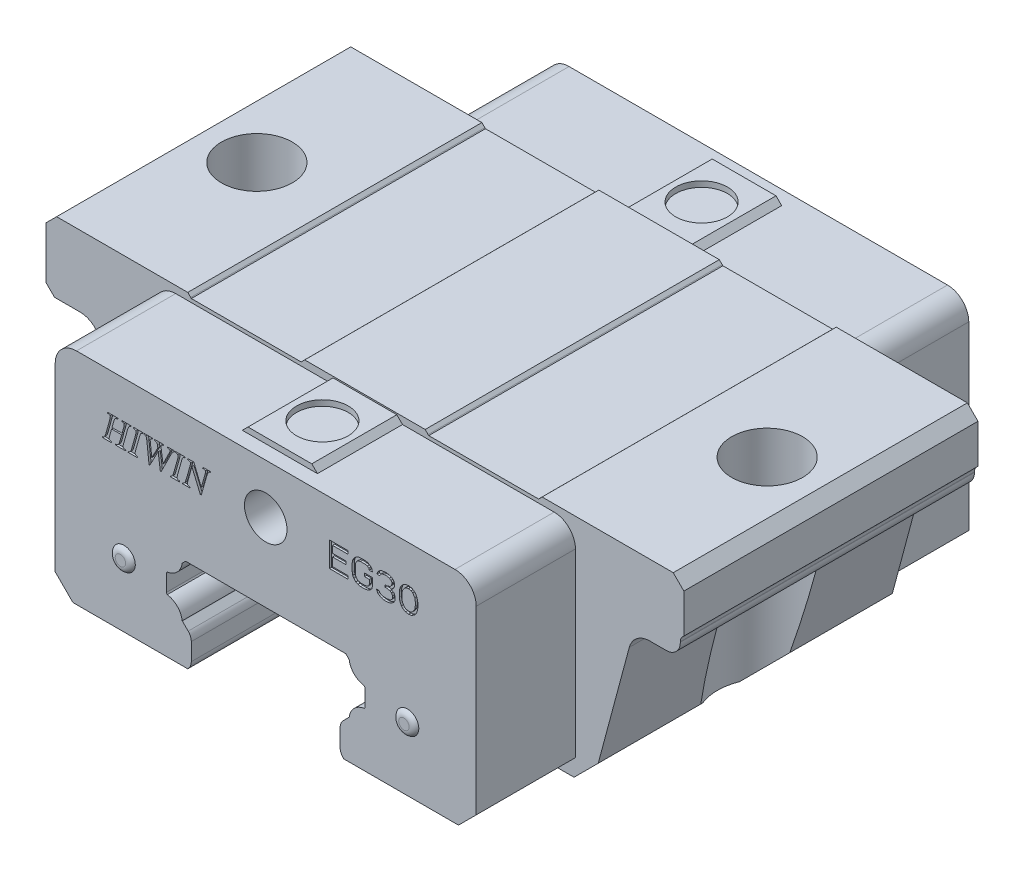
SolidWorks part; units mm, degrees
ref_plane "前视基准面" through (0, 0, 0) normal (0, 0, 1) x (1, 0, 0)
ref_plane "上视基准面" through (0, 0, 0) normal (0, 1, 0) x (1, 0, 0)
ref_plane "右视基准面" through (0, 0, 0) normal (1, 0, 0) x (0, 0, -1)
imported_body "输入1"
sketch "草图1" plane through (0, 0, 14) normal (0, 0, 1) x (1, 0, 0)
  line L0 (0, 0) -> (0, -23) construction
  line L1 (-43.5, 19) -> (-25, 19) construction
  line L23 (-10.9393, -12.9393) -> (-13.5607, -15.5607)
  line L24 (-11.7582, -7.5418) -> (-10.9393, -8.3607)
  line L25 (4.5, -22.5) -> (5, -23)
  line L26 (10.5, -11.8787) -> (10.5, -9.4213)
  line L27 (14, -5.152) -> (14, -2.848)
  line L28 (-5, -23) -> (5, -23) construction
  line L29 (-12.5, -23) -> (-5, -23)
  line L30 (-5, -23) -> (-4.5, -22.5)
  line L31 (-14, -21.5) -> (-12.5, -23)
  line L32 (10.9393, -8.3607) -> (11.7582, -7.5418)
  line L33 (-11.3, 0) -> (-11.7582, -0.4582)
  line L34 (14, -21.5) -> (14, -16.6213)
  line L35 (11.7582, -0.4582) -> (11.3, 0)
  line L36 (12.5, -23) -> (14, -21.5)
  line L37 (5, -23) -> (12.5, -23)
  line L38 (-10.5, -9.4213) -> (-10.5, -11.8787)
  line L39 (-14, -2.848) -> (-14, -5.152)
  line L40 (13.5607, -15.5607) -> (10.9393, -12.9393)
  line L41 (11.3, 0) -> (-11.3, 0)
  line L42 (-14, -16.6213) -> (-14, -21.5)
  line L43 (-4.5, -22.5) -> (4.5, -22.5)
  arc A18 (-11.7782, -7.5198) -> (-13.8926, -5.382) centre (-14.2555, -7.8555) ccw
  arc A19 (-10.9393, -12.9393) -> (-10.5, -11.8787) centre (-12, -11.8787) ccw
  arc A20 (10.5, -11.8787) -> (10.9393, -12.9393) centre (12, -11.8787) ccw
  arc A21 (11.7582, -7.5418) -> (11.7782, -7.5198) centre (11.5461, -7.3297) ccw
  arc A22 (11.7782, -0.4802) -> (11.7582, -0.4582) centre (11.5461, -0.6703) ccw
  arc A23 (14, -16.6213) -> (13.5607, -15.5607) centre (12.5, -16.6213) ccw
  arc A24 (14, -2.848) -> (13.8926, -2.618) centre (13.7, -2.848) ccw
  arc A25 (13.8926, -5.382) -> (11.7782, -7.5198) centre (14.2555, -7.8555) ccw
  arc A26 (-13.8926, -2.618) -> (-14, -2.848) centre (-13.7, -2.848) ccw
  arc A27 (11.7782, -0.4802) -> (13.8926, -2.618) centre (14.2555, -0.1445) ccw
  arc A28 (-13.8926, -2.618) -> (-11.7782, -0.4802) centre (-14.2555, -0.1445) ccw
  arc A29 (-11.7582, -0.4582) -> (-11.7782, -0.4802) centre (-11.5461, -0.6703) ccw
  arc A30 (13.8926, -5.382) -> (14, -5.152) centre (13.7, -5.152) ccw
  arc A31 (-14, -5.152) -> (-13.8926, -5.382) centre (-13.7, -5.152) ccw
  arc A32 (-11.7782, -7.5198) -> (-11.7582, -7.5418) centre (-11.5461, -7.3297) ccw
  arc A33 (-10.5, -9.4213) -> (-10.9393, -8.3607) centre (-12, -9.4213) ccw
  arc A34 (-13.5607, -15.5607) -> (-14, -16.6213) centre (-12.5, -16.6213) ccw
  arc A35 (10.9393, -8.3607) -> (10.5, -9.4213) centre (12, -9.4213) ccw
  dimension "D1" = 42
extrude "切除-拉伸1" cut sketch "草图1" against normal through all
sketch "草图2" plane through (0, 0, 0) normal (0, 0, 1) x (1, 0, 0)
  line L0 (-26.7, 18) -> (26.7, 18) construction
  line L1 (-25.8781, 18) -> (24.674, 18)
  line L2 (-25.8781, 18) -> (-25.8781, 18.5)
  line L3 (-25.8781, 18.5) -> (24.674, 18.5)
  line L4 (24.674, 18) -> (24.674, 18.5)
  line L5 (25, 19) -> (43.5, 19) construction
  dimension "D1" = 0.5
extrude "凸台-拉伸1" add sketch "草图2" against normal up to surface (41.5 mm away)
